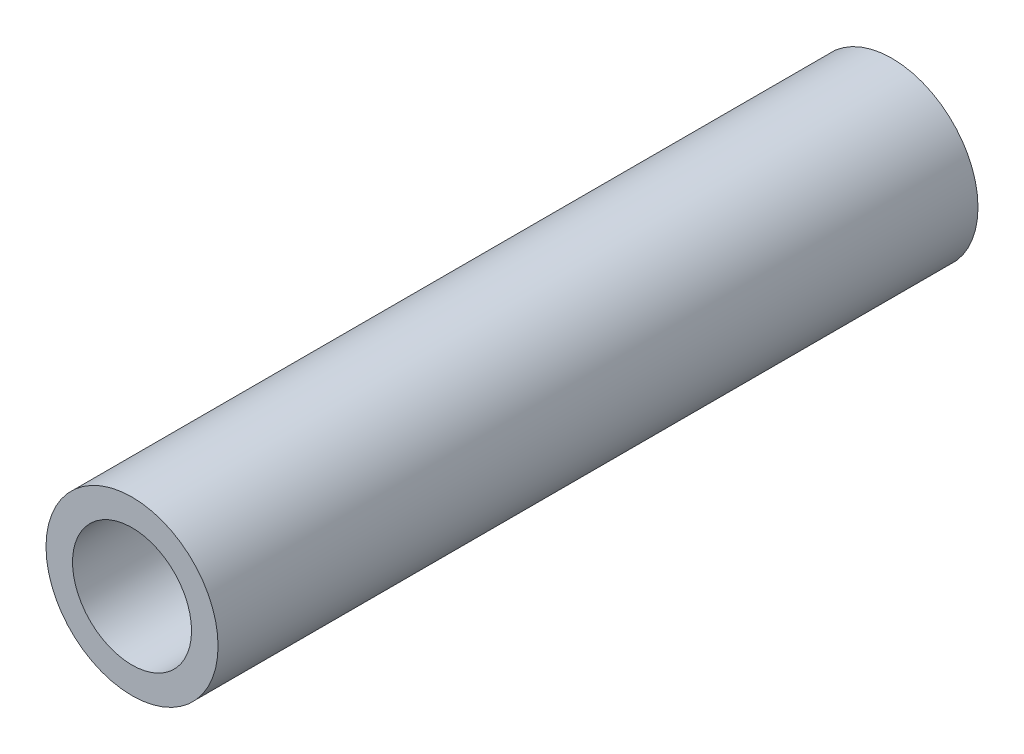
SolidWorks part; units mm, degrees
ref_plane "Face" through (0, 0, 0) normal (0, 0, 1) x (1, 0, 0)
ref_plane "Dessus" through (0, 0, 0) normal (0, 1, 0) x (1, 0, 0)
ref_plane "Droite" through (0, 0, 0) normal (1, 0, 0) x (0, 0, -1)
sketch "Esquisse1" plane through (0, 0, 0) normal (0, 0, 1) x (1, 0, 0)
  circle A0 centre (190, -10) radius 6
  arc A1 (189.925, -4.0005) -> (190.075, -4.0005) centre (190, -10) ccw construction
  circle A2 centre (190, -10) radius 4.15
  dimension "D1" = 8.3
extrude "Extrusion1" add sketch "Esquisse1" along normal mid plane 53
